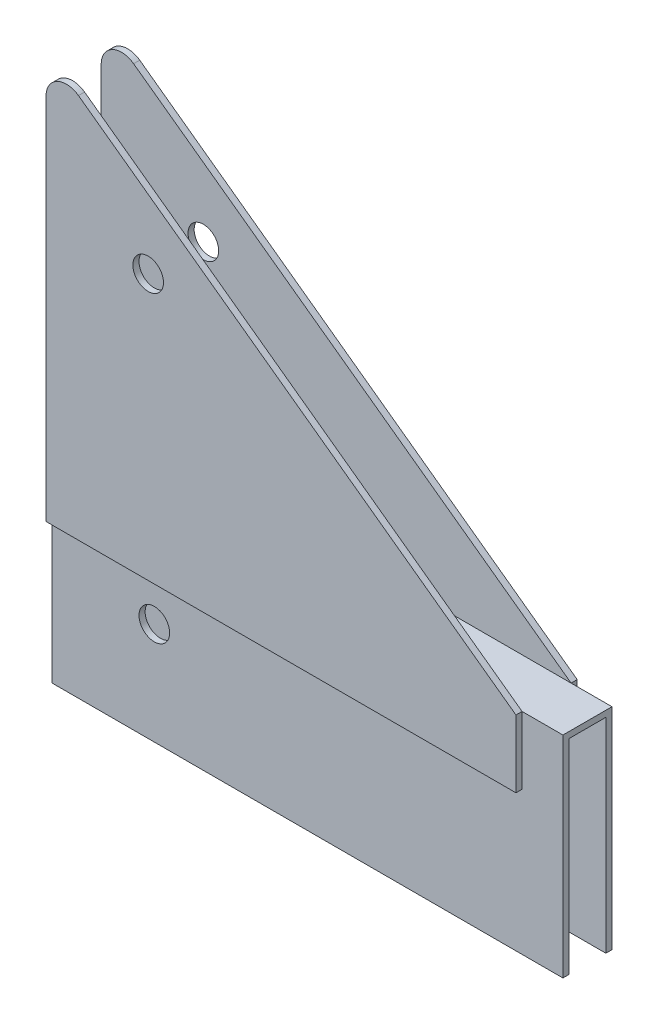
SolidWorks part; units mm, degrees
ref_plane "Plan de face" through (0, 0, 0) normal (0, 0, 1) x (1, 0, 0)
ref_plane "Plan de dessus" through (0, 0, 0) normal (0, 1, 0) x (1, 0, 0)
ref_plane "Plan de droite" through (0, 0, 0) normal (1, 0, 0) x (0, 0, -1)
sketch "Esquisse1" plane through (0, 0, 0) normal (1, 0, 0) x (0, 0, -1)
  line L0 (0, 0) -> (0, 100)
  line L1 (0, 100) -> (18, 100)
  line L2 (18, 100) -> (18, 0)
  line L3 (0, 0) -> (-3, 0)
  line L4 (-3, 0) -> (-3, 103)
  line L5 (-3, 103) -> (21, 103)
  line L6 (21, 103) -> (21, 0)
  line L7 (21, 0) -> (18, 0)
  dimension "D1" = 18
  dimension "D2" = 100
  dimension "D3" = 100
  dimension "D4" = 3
  dimension "D5" = 3
  dimension "D6" = 3
extrude "Boss.-Extru.1" add sketch "Esquisse1" along normal blind 250
ref_plane "Plan1" through (250, 103, 3) normal (-1, 0, 0) x (0, 0, 1)
sketch "Esquisse3" plane through (0, 0, 3) normal (0, 0, 1) x (1, 0, 0)
  line L0 (0, 70) -> (0, 270)
  line L1 (0, 103) -> (0, 0) construction
  line L2 (0, 270) -> (230, 103)
  line L3 (250, 103) -> (0, 103) construction
  line L4 (230, 103) -> (230, 70)
  line L5 (230, 70) -> (0, 70)
  line L6 (250, 0) -> (0, 0) construction
  dimension "D1" = 70
  dimension "D2" = 200
  dimension "D3" = 230
extrude "Boss.-Extru.2" add sketch "Esquisse3" along normal blind 3
fillet "Congé1" radius 10 1 edges at (0, 270, 4.5)
pattern_linear "Répétition linéaire1" count 2 spacing 27 along (0, 0, -1) of "Boss.-Extru.2", "Congé1"
sketch "Esquisse4" plane through (0, 0, 6) normal (0, 0, 1) x (1, 0, 0)
  line L0 (0, 250.3811) -> (0, 70) construction
  line L1 (250, 0) -> (0, 0) construction
  line L2 (0, 70) -> (0, 0) construction
  circle A0 centre (50, 200) radius 7.5
  circle A2 centre (50, 50) radius 7.5
  dimension "D1" = 15
  dimension "D2" = 50
  dimension "D3" = 200
  dimension "D4" = 15
  dimension "D5" = 50
  dimension "D6" = 50
extrude "Enlèv. mat.-Extru.1" cut sketch "Esquisse4" against normal through all
